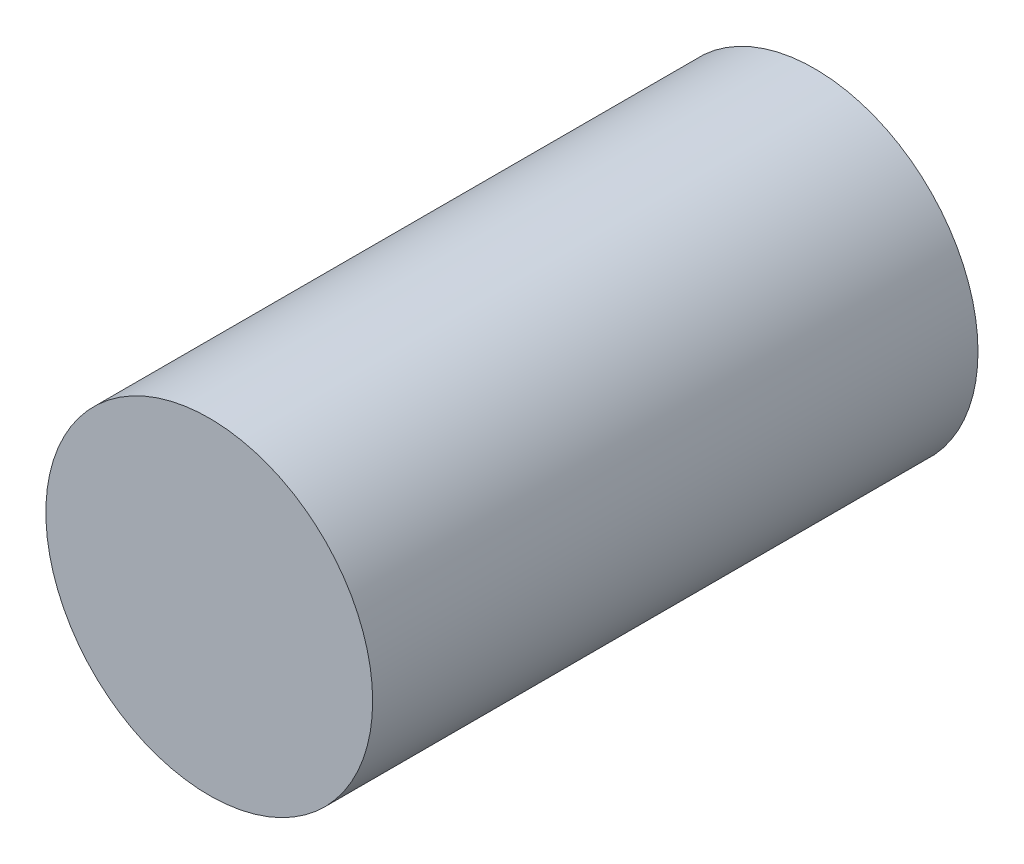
SolidWorks part; units mm, degrees
ref_plane "Front Plane" through (0, 0, 0) normal (0, 0, 1) x (1, 0, 0)
ref_plane "Top Plane" through (0, 0, 0) normal (0, 1, 0) x (1, 0, 0)
ref_plane "Right Plane" through (0, 0, 0) normal (1, 0, 0) x (0, 0, -1)
sketch "Sketch1" plane through (0, 0, 0) normal (0, 0, 1) x (1, 0, 0)
  circle A0 centre (0, 0) radius 82.55 construction
  circle A1 centre (0, 0) radius 82.55
extrude "Extrude1" add sketch "Sketch1" against normal up to surface (305.816 mm away)
